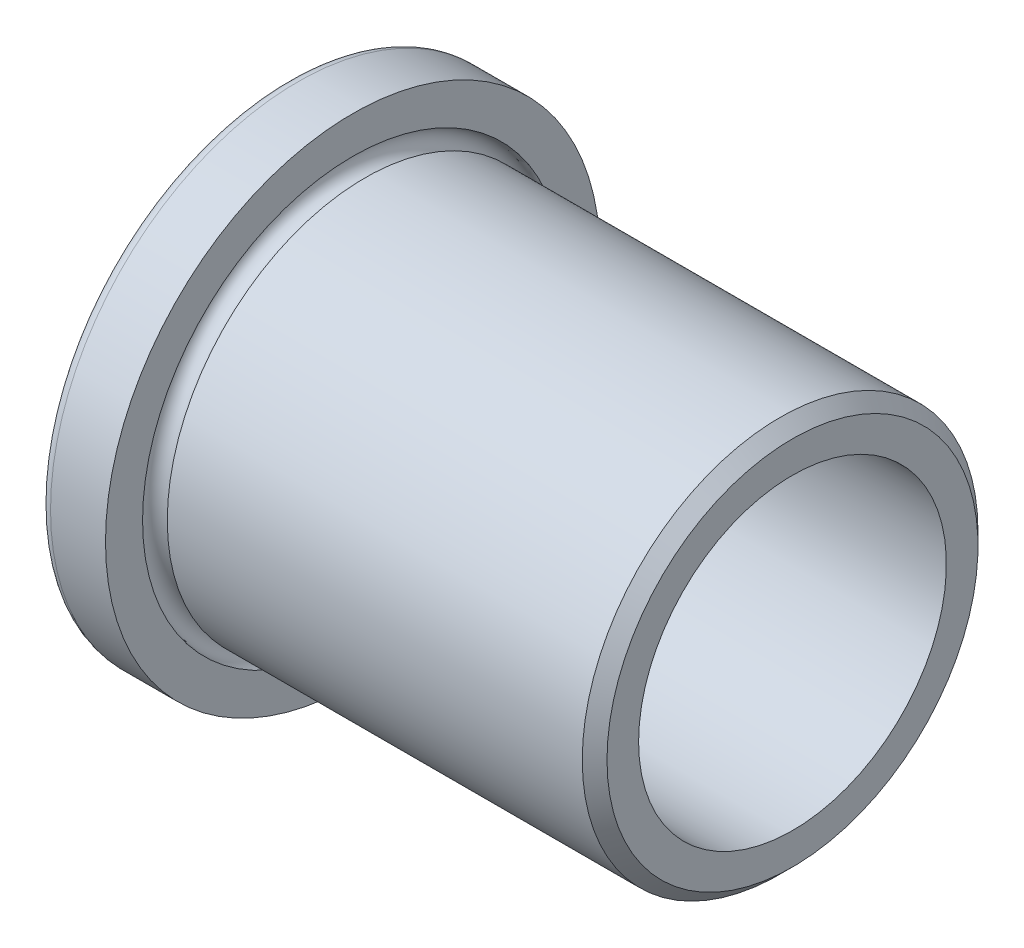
SolidWorks part; units mm, degrees
ref_plane "Plane1" through (0, 0, 0) normal (0, 0, 1) x (1, 0, 0)
ref_plane "Plane2" through (0, 0, 0) normal (0, 1, 0) x (1, 0, 0)
ref_plane "Plane3" through (0, 0, 0) normal (1, 0, 0) x (0, 0, -1)
sketch "Sketch1" plane through (0, 0, 0) normal (0, 0, 1) x (1, 0, 0)
  line L0 (0, 0) -> (76.2, 0) construction
  line L1 (0, 25.4) -> (0, 34.1249)
  line L2 (1.5875, 35.7124) -> (9.525, 35.7124)
  line L3 (9.525, 35.7124) -> (9.525, 30.3593)
  line L4 (11.3093, 28.575) -> (71.2391, 28.575)
  line L5 (71.2391, 28.575) -> (73.025, 26.7891)
  line L6 (73.025, 26.7891) -> (73.025, 22.225)
  line L7 (73.025, 22.225) -> (3.175, 22.225)
  line L8 (71.2391, -28.575) -> (73.025, -26.7891) construction
  line L9 (73.025, -22.225) -> (0, -22.225) construction
  line L10 (11.3093, -28.575) -> (71.2391, -28.575) construction
  line L11 (0, -35.7124) -> (9.525, -35.7124) construction
  arc A0 (9.525, 30.3593) -> (11.3093, 28.575) centre (9.525, 28.575) ccw
  arc A1 (0, 25.4) -> (3.175, 22.225) centre (3.175, 25.4) ccw
  arc A2 (1.5875, 35.7124) -> (0, 34.1249) centre (1.5875, 34.1249) ccw
  point P20 (0, 22.225)
  point P23 (0, 35.7124)
  dimension "Head_radius" = 3.175
  dimension "D1" = 1.7843
  dimension "D4" = 1.5875
  dimension "Hole_dia" = 44.45
  dimension "Body_dia" = 57.15
  dimension "Head_dia" = 71.4248
  dimension "Head_thickness" = 9.525
  dimension "D2" = 53.5781
  dimension "D3" = 45
  dimension "Body_len" = 63.5
revolve "BaseBody" add sketch "Sketch1" angle 360 about L0
equation "\"D2@Sketch1\" = \"Body_dia@Sketch1\" * .9375"
equation "\"D4@Sketch1\" = \"Head_radius@Sketch1\" / 2"
equation "\"D1@Sketch1\" =  (  ( \"Head_dia@Sketch1\" - \"Body_dia@Sketch1\" )  / 2 )  / 4"
